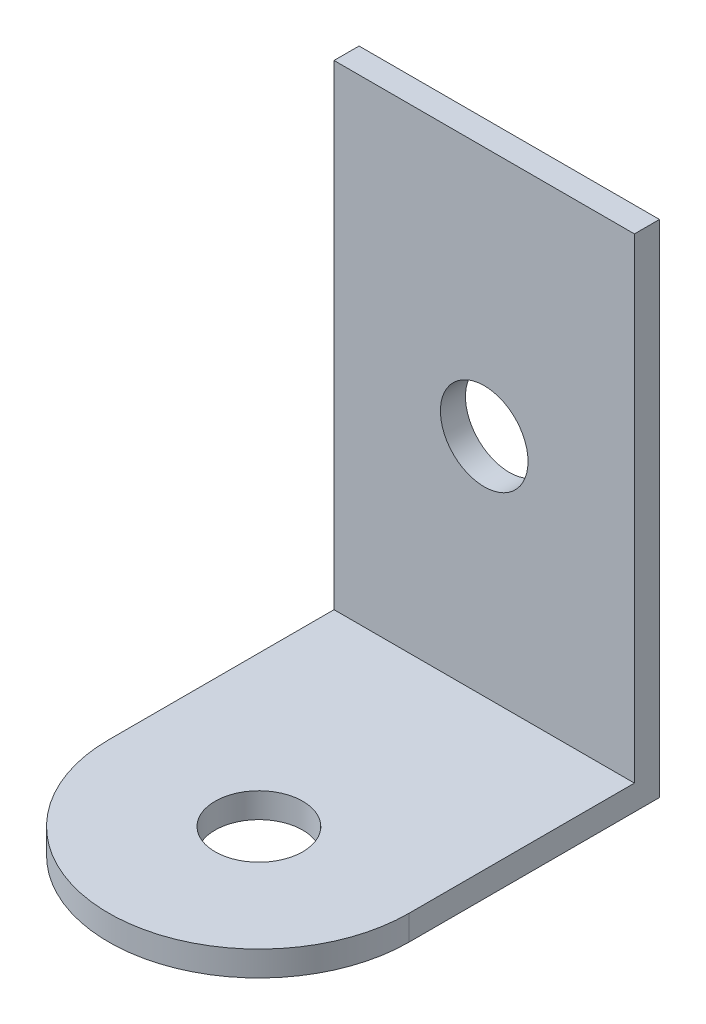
SolidWorks part; units mm, degrees
ref_plane "Front Plane" through (0, 0, 0) normal (0, 0, 1) x (1, 0, 0)
ref_plane "Top Plane" through (0, 0, 0) normal (0, 1, 0) x (1, 0, 0)
ref_plane "Right Plane" through (0, 0, 0) normal (1, 0, 0) x (0, 0, -1)
sketch "Sketch1" plane through (0, 0, 0) normal (0, 0, 1) x (1, 0, 0)
  line L0 (6, 20) -> (6, 0) construction
  line L1 (0, 0) -> (12, 0)
  line L2 (0, 0) -> (0, 20)
  line L3 (0, 20) -> (12, 20)
  line L4 (12, 0) -> (12, 20)
  circle A0 centre (6, 10) radius 1.75
  dimension "D1" = 3.5
  dimension "D4" = 10
  dimension "D2" = 12
  dimension "D3" = 20
extrude "Extrude1" add sketch "Sketch1" along normal blind 1
sketch "Sketch3" plane through (0, 0, 0) normal (0, -1, 0) x (1, 0, 0)
  line L0 (12, 10) -> (0, 10) construction
  line L1 (0, 0) -> (12, 0)
  line L2 (0, 0) -> (0, 10)
  line L4 (12, 0) -> (12, 10)
  arc A0 (12, 10) -> (0, 10) centre (6, 10) ccw
  circle A1 centre (6, 10) radius 1.75
  dimension "D2" = 3.5
  dimension "D3" = 10
  dimension "D1" = 12
extrude "Extrude2" add sketch "Sketch3" against normal blind 1
